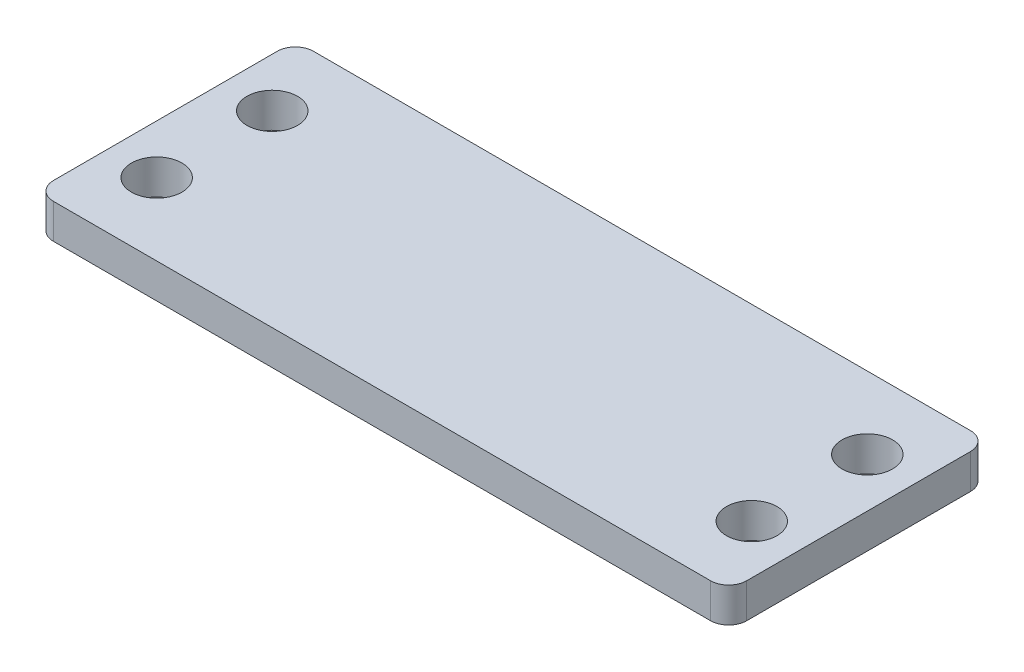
SolidWorks part; units mm, degrees
ref_plane "Front Plane" through (0, 0, 0) normal (0, 0, 1) x (1, 0, 0)
ref_plane "Top Plane" through (0, 0, 0) normal (0, 1, 0) x (1, 0, 0)
ref_plane "Right Plane" through (0, 0, 0) normal (1, 0, 0) x (0, 0, -1)
imported_body "Imported1"
other "DeleteFace1"
